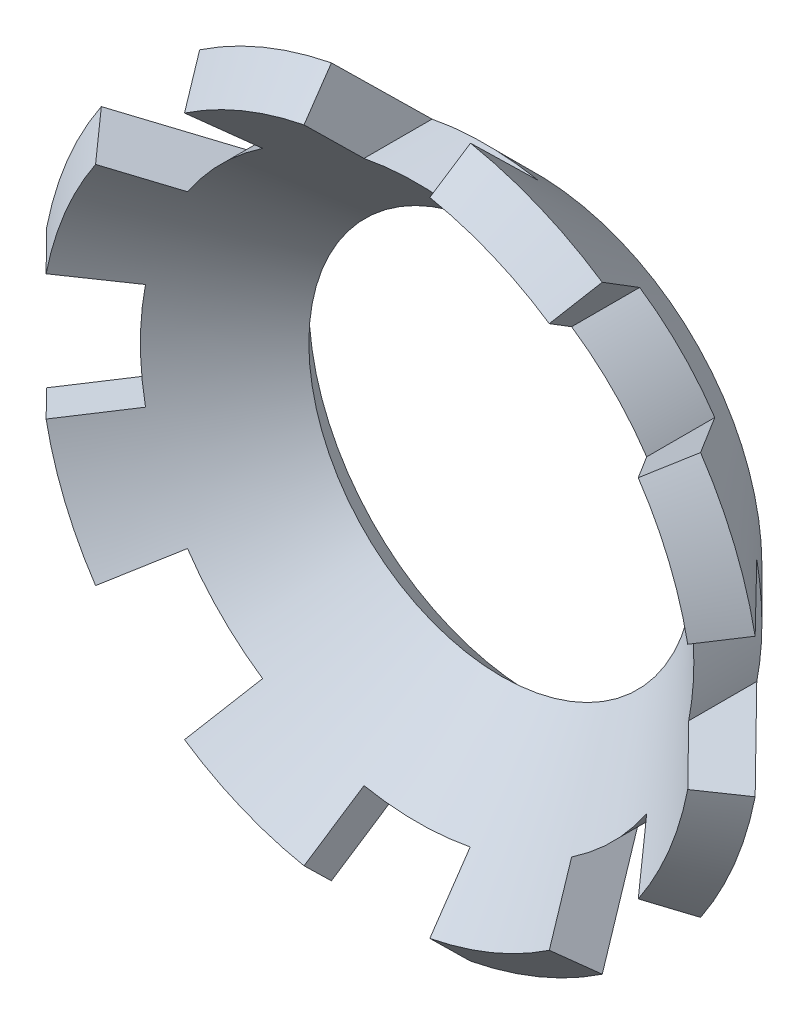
SolidWorks part; units mm, degrees
ref_plane "Front Plane" through (0, 0, 0) normal (0, 0, 1) x (1, 0, 0)
ref_plane "Top Plane" through (0, 0, 0) normal (0, 1, 0) x (1, 0, 0)
ref_plane "Right Plane" through (0, 0, 0) normal (1, 0, 0) x (0, 0, -1)
sketch "BodySke" plane through (0, 0, 0) normal (0, 1, 0) x (1, 0, 0)
  line L0 (0, -1.6) -> (0, 3.997) construction
  line L1 (0, 0) -> (3, 0) construction
  line L2 (3, 0) -> (0.5887, 2.4113) construction
  line L3 (3, 0) -> (1.8828, 1.1172)
  line L4 (3, 0) -> (2.7172, -0.2828)
  line L5 (2.7172, -0.2828) -> (1.6, 0.8343)
  line L6 (1.6, 0.8343) -> (1.8828, 1.1172)
  line L7 (0, 0) -> (-8, 0) construction
  dimension "Angle" = 45
  dimension "Outer_dia" = 6
  dimension "Inner_dia" = 3.2
  dimension "Thickness" = 0.4
  dimension "Num_tooth" = 8
revolve "BaseBody" add sketch "BodySke" angle 360 about L0
sketch "ToothSke" plane through (0, 0, 0) normal (0, 0, 1) x (1, 0, 0)
  line L0 (0, 0) -> (4.8783, 0) construction
  line L1 (2.2573, 0.4413) -> (3, 0.589)
  line L2 (3, -0.589) -> (3, 0.589)
  line L3 (2.2573, -0.4413) -> (3, -0.589)
  circle A0 centre (0, 0) radius 3 construction
  circle A1 centre (0, 0) radius 3 construction
  arc A2 (-2.3, 0) -> (2.2573, 0.4413) centre (0, 0) ccw construction
  arc A3 (2.2573, -0.4413) -> (2.2573, 0.4413) centre (0, 0) ccw
  point P9 (3, 0)
  dimension "D1" = 4.6
  dimension "D2" = 1.1781
  dimension "D3" = 22.5
extrude "ToothCut" cut sketch "ToothSke" against normal through all and the other way through all
pattern_circular "ToothPat" count 8 over 360 about axis through (0, 0, 0) along (0, 0, 1) of "ToothCut"
equation "\"D1@ToothSke\" =  ( \"Outer_dia@BodySke\" + \"Inner_dia@BodySke\" )  / 2"
equation "\"D2@ToothSke\" = pi  * \"Outer_dia@BodySke\" / 2 / \"Num_tooth@BodySke\""
equation "\"Num_tooth@ToothPat\" = \"Num_tooth@BodySke\""
equation "\"D3@ToothSke\" = 360 / 2 / \"Num_tooth@BodySke\""
